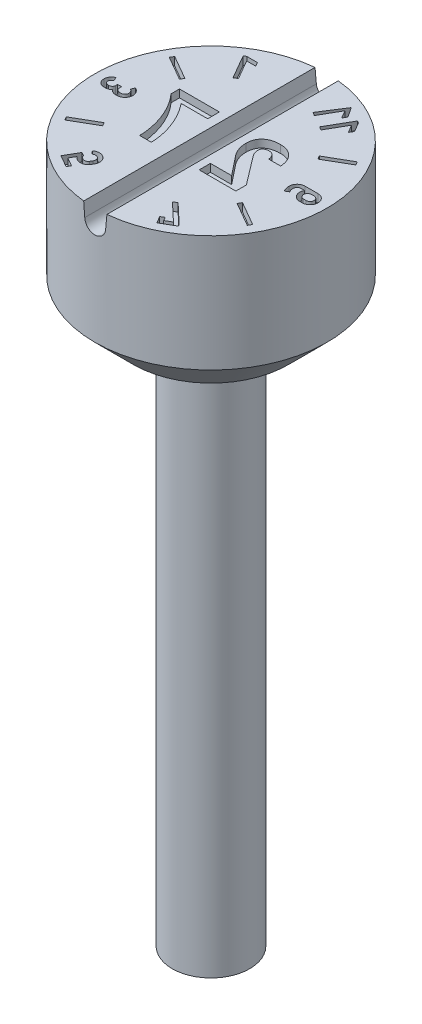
SolidWorks part; units mm, degrees
ref_plane "Front Plane" through (0, 0, 0) normal (0, 0, 1) x (1, 0, 0)
ref_plane "Top Plane" through (0, 0, 0) normal (0, 1, 0) x (1, 0, 0)
ref_plane "Right Plane" through (0, 0, 0) normal (1, 0, 0) x (0, 0, -1)
imported_body "Imported1"
sketch "Sketch1" plane through (0, -0.1, 0) normal (0, 1, 0) x (1, 0, 0)
  line L2 (-0.2515, -0.181) -> (-0.2515, 0.1827)
  line L3 (-0.7302, 0.1827) -> (-0.7302, -0.181)
  line L4 (-0.2515, -0.181) -> (-0.2515, 0.1827)
  line L5 (-0.7302, 0.1827) -> (-0.7302, -0.181)
  spline S4 degree 3 poles (1149.3423, 2770.4808) (-75.259, -19.3011) (0.5183, -3.6334) (-0.2597, 0.2566) (-0.2664, 0.2785) (-0.275, 0.2988) (-0.2857, 0.3176) (-0.2982, 0.3349) (-0.3126, 0.3506) (-0.3287, 0.3647) (-0.3469, 0.3768) (-0.3667, 0.3871) (-0.3882, 0.3956) (-0.4114, 0.4021) (-3.7982, 1.0142) (-14.2431, -50.136) (1463.224, 2618.8695) knots -31.351127 -31.351127 -31.351127 -31.351127 0.136229 0.199072 0.25942 0.317893 0.375172 0.431376 0.487845 0.544707 0.602193 0.661345 0.722459 0.786428 0.853446 28.151462 28.151462 28.151462 28.151462 only from (-0.2515, 0.1827) to (-0.4908, 0.4099)
  spline S5 degree 3 poles (-1510.1769, 2592.7872) (13.5914, -51.7487) (2.908, 1.0247) (-0.5705, 0.4021) (-0.5938, 0.3956) (-0.6152, 0.3871) (-0.6351, 0.377) (-0.6531, 0.3649) (-0.6693, 0.3507) (-0.6837, 0.3351) (-0.6961, 0.3178) (-0.7069, 0.2991) (-0.7153, 0.2787) (-0.7219, 0.2568) (-1.2023, -1.9819) (31.9025, -9.4238) (-2856.2766, 919.4719) knots -27.868135 -27.868135 -27.868135 -27.868135 0.146896 0.214298 0.278228 0.339305 0.397836 0.455287 0.512114 0.568549 0.624718 0.681585 0.739853 0.800578 0.863471 18.967229 18.967229 18.967229 18.967229 only from (-0.4908, 0.4099) to (-0.7302, 0.1827)
  spline S6 degree 3 poles (-278.1287, -2986.3987) (78.7429, 20.328) (-1.5271, 3.7754) (-0.722, -0.2549) (-0.7153, -0.2767) (-0.7066, -0.297) (-0.696, -0.3159) (-0.6834, -0.3332) (-0.6689, -0.349) (-0.6528, -0.3631) (-0.6347, -0.3752) (-0.6149, -0.3855) (-0.5933, -0.3937) (-0.5702, -0.4006) (4.1494, -1.2207) (19.7233, 87.5457) (-2516.6025, -1632.923) knots -32.499024 -32.499024 -32.499024 -32.499024 0.135837 0.198699 0.259064 0.317554 0.374849 0.431675 0.488161 0.545039 0.602541 0.661711 0.722684 0.786373 0.853837 38.888742 38.888742 38.888742 38.888742 only from (-0.7302, -0.181) to (-0.4908, -0.4083)
  spline S7 degree 3 poles (1043.7275, -2812.764) (-11.7013, 39.304) (-3.2805, -0.9365) (-0.4036, -0.3989) (-0.3735, -0.3888) (-0.3465, -0.3749) (-0.3284, -0.3626) (-0.3122, -0.3483) (-0.2978, -0.3325) (-0.2854, -0.3151) (-0.2748, -0.2963) (-0.2664, -0.276) (-0.2597, -0.2543) (0.2425, 2.1127) (-35.3089, 9.9981) (2828.3844, -999.2905) knots -22.993067 -22.993067 -22.993067 -22.993067 0.147075 0.214639 0.339917 0.399105 0.456869 0.514052 0.570876 0.627466 0.684188 0.742528 0.802498 0.865468 20.026276 20.026276 20.026276 20.026276 only from (-0.4908, -0.4083) to (-0.2515, -0.181)
  spline S8 degree 3 poles (-0.2515, 0.1827) (-0.2515, 0.1998) (-0.2533, 0.2247) (-0.2597, 0.2566) (-0.2664, 0.2785) (-0.275, 0.2988) (-0.2857, 0.3176) (-0.2982, 0.3349) (-0.3126, 0.3506) (-0.3287, 0.3647) (-0.3469, 0.3768) (-0.3667, 0.3871) (-0.3882, 0.3956) (-0.4114, 0.4021) (-0.4457, 0.4083) (-0.4725, 0.4099) (-0.4908, 0.4099) knots 0 0 0 0 0.136229 0.199072 0.25942 0.317893 0.375172 0.431376 0.487845 0.544707 0.602193 0.661345 0.722459 0.786428 0.853446 1 1 1 1
  spline S9 degree 3 poles (-0.4908, 0.4099) (-0.5093, 0.4099) (-0.5362, 0.4083) (-0.5705, 0.4021) (-0.5938, 0.3956) (-0.6152, 0.3871) (-0.6351, 0.377) (-0.6531, 0.3649) (-0.6693, 0.3507) (-0.6837, 0.3351) (-0.6961, 0.3178) (-0.7069, 0.2991) (-0.7153, 0.2787) (-0.7219, 0.2568) (-0.7288, 0.2249) (-0.73, 0.1998) (-0.7302, 0.1827) knots 0 0 0 0 0.146896 0.214298 0.278228 0.339305 0.397836 0.455287 0.512114 0.568549 0.624718 0.681585 0.739853 0.800578 0.863471 1 1 1 1
  spline S10 degree 3 poles (-0.7302, -0.181) (-0.7302, -0.1981) (-0.7283, -0.223) (-0.722, -0.2549) (-0.7153, -0.2767) (-0.7066, -0.297) (-0.696, -0.3159) (-0.6834, -0.3332) (-0.6689, -0.349) (-0.6528, -0.3631) (-0.6347, -0.3752) (-0.6149, -0.3855) (-0.5933, -0.3937) (-0.5702, -0.4006) (-0.5359, -0.4065) (-0.5092, -0.4083) (-0.4908, -0.4083) knots 0 0 0 0 0.135837 0.198699 0.259064 0.317554 0.374849 0.431675 0.488161 0.545039 0.602541 0.661711 0.722684 0.786373 0.853837 1 1 1 1
  spline S11 degree 3 poles (-0.4908, -0.4083) (-0.4724, -0.4082) (-0.4455, -0.4067) (-0.4036, -0.3989) (-0.3735, -0.3888) (-0.3465, -0.3749) (-0.3284, -0.3626) (-0.3122, -0.3483) (-0.2978, -0.3325) (-0.2854, -0.3151) (-0.2748, -0.2963) (-0.2664, -0.276) (-0.2597, -0.2543) (-0.253, -0.2227) (-0.2517, -0.1979) (-0.2515, -0.181) knots 0 0 0 0 0.147075 0.214639 0.339917 0.399105 0.456869 0.514052 0.570876 0.627466 0.684188 0.742528 0.802498 0.865468 1 1 1 1
  dimension "D1" = 0
extrude "Boss-Extrude1" add sketch "Sketch1" along normal up to vertex
sketch "Sketch2" plane through (0, 0, 0) normal (0, 1, 0) x (1, 0, 0)
  line L0 (0.2474, -0.4) -> (0.7205, -0.4) construction
  text T0 "7" font "Arial" height 0.7874
extrude "Cut-Extrude1" cut sketch "Sketch2" against normal up to surface (0.1 mm away)
